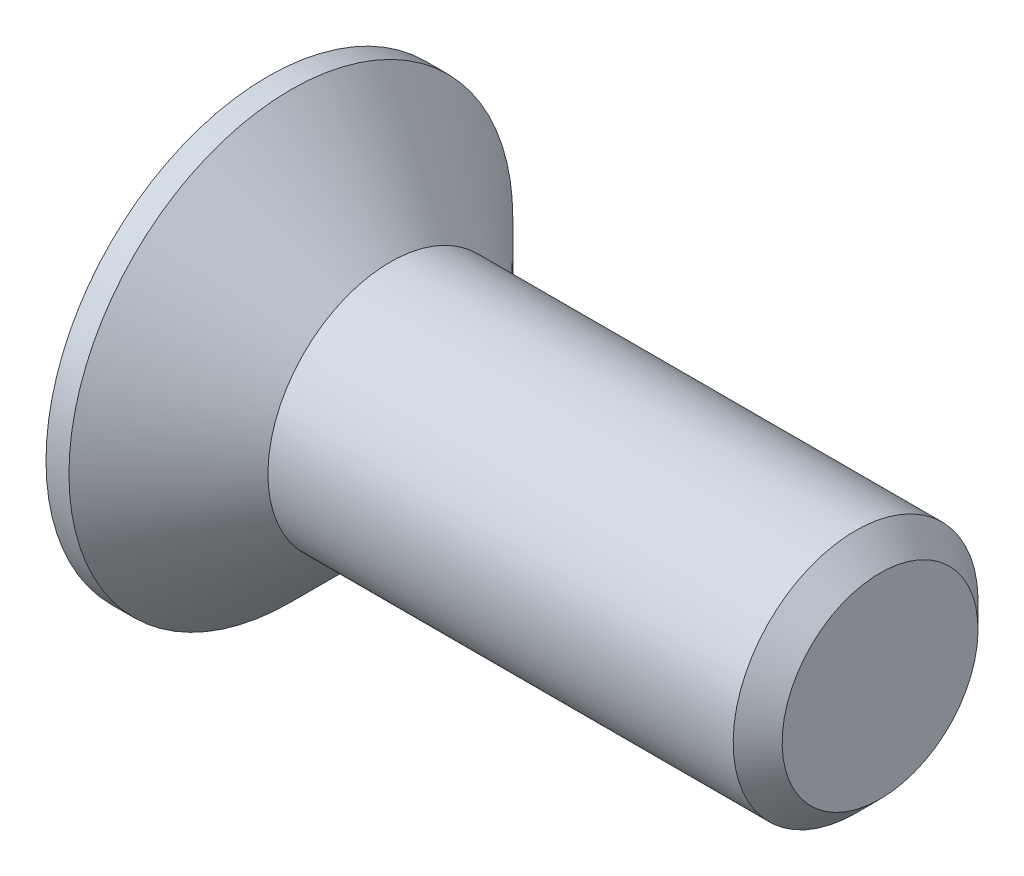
SolidWorks part; units mm, degrees
ref_plane "Front Plane" through (0, 0, 0) normal (0, 0, 1) x (1, 0, 0)
ref_plane "Top Plane" through (0, 0, 0) normal (0, 1, 0) x (1, 0, 0)
ref_plane "Right Plane" through (0, 0, 0) normal (1, 0, 0) x (0, 0, -1)
sketch "Sketch1" plane through (0, 0, 0) normal (0, 0, 1) x (1, 0, 0)
  line L1 (-4, 7.25) -> (-4, 0)
  line L2 (-4, 0) -> (16, 0)
  line L3 (16, 0) -> (16, 4)
  line L4 (16, 4) -> (0, 4)
  line L5 (-4, 7.25) -> (-3.25, 7.25)
  line L6 (-3.25, 7.25) -> (0, 4)
  dimension "D1" = 4
  dimension "D2" = 45
  dimension "D3" = 4
  dimension "D4" = 20
  dimension "D5" = 7.25
revolve "Revolve1" add sketch "Sketch1" angle 360 about L2
chamfer "Chamfer1" distance 0.8 angle 45 1 edges at (16, -4, 0)
sketch "Sketch2" plane through (-4, 0, 0) normal (-1, 0, 0) x (0, 0, 1)
  line L0 (-1.09, 4.35) -> (1.09, 4.35)
  line L1 (1.09, 4.35) -> (1.09, 1.09)
  line L2 (1.09, 1.09) -> (4.35, 1.09)
  line L3 (4.35, 1.09) -> (4.35, -1.09)
  line L4 (4.35, -1.09) -> (1.09, -1.09)
  line L5 (1.09, -1.09) -> (1.09, -4.35)
  line L6 (1.09, -4.35) -> (-1.09, -4.35)
  line L7 (-1.09, -4.35) -> (-1.09, -1.09)
  line L8 (-1.09, -1.09) -> (-4.35, -1.09)
  line L9 (-4.35, -1.09) -> (-4.35, 1.09)
  line L10 (-4.35, 1.09) -> (-1.09, 1.09)
  line L11 (-1.09, 1.09) -> (-1.09, 4.35)
  point P2 (0, 4.35)
  point P14 (0, -4.35)
  point P15 (4.35, 0)
  point P16 (-4.35, 0)
  dimension "D1" = 8.7
  dimension "D2" = 2.18
extrude "Cut-Extrude1" cut sketch "Sketch2" against normal blind 3.45
